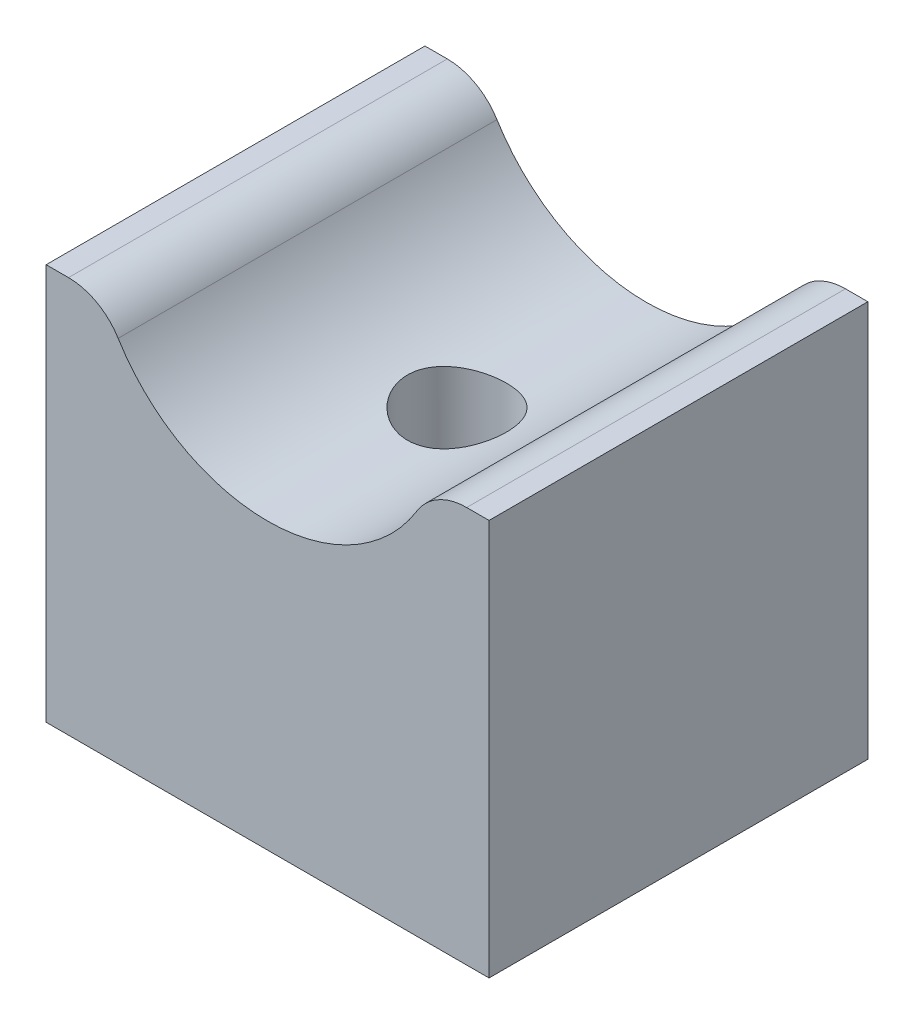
SolidWorks part; units mm, degrees
ref_plane "Ebene vorne" through (0, 0, 0) normal (0, 0, 1) x (1, 0, 0)
ref_plane "Ebene oben" through (0, 0, 0) normal (0, 1, 0) x (1, 0, 0)
ref_plane "Ebene rechts" through (0, 0, 0) normal (1, 0, 0) x (0, 0, -1)
sketch "Skizze1" plane through (0, 0, 0) normal (0, 0, 1) x (1, 0, 0)
  line L1 (-19, 17) -> (19, 17)
  line L2 (-19, 17) -> (-19, -17)
  line L3 (-19, -17) -> (19, -17)
  line L4 (19, 17) -> (19, -17)
  line L5 (-19, 17) -> (19, -17) construction
  line L6 (-19, -17) -> (19, 17) construction
  point P0 (0, 0)
  dimension "D1" = 38
  dimension "D2" = 34
extrude "Aufsatz-Linear austragen1" add sketch "Skizze1" along normal blind 32.5
sketch "Skizze2" plane through (0, 0, 0) normal (0, 0, 1) x (1, 0, 0)
  line L0 (0, 0) -> (0, 18.251) construction
  line L1 (-19, -17) -> (19, -17) construction
  circle A0 centre (0, 22.5) radius 15.05
  dimension "D1" = 39.5
  dimension "D2" = 30.1
extrude "Schnitt-Linear austragen1" cut sketch "Skizze2" along normal through all
sketch "Skizze3" plane through (0, -17, 0) normal (0, -1, 0) x (1, 0, 0)
  line L0 (-19, 0) -> (19, 0) construction
  point P0 (0, 16.25)
  dimension "D1" = 16.25
hole_wizard "Stirnsenkung für M8 Zylinderschraube mit Innensechskant1" positions "3D-Skizze1" profile "Skizze4" counterbore size "M8" standard "DIN"
sketch3d "3D-Skizze1"
  point P0 (0, -17, 16.25)
sketch "Skizze4" plane through (0, -17, 16.25) normal (1, 0, 0) x (0, 0, -1)
  line L0 (0, 0) -> (0, 34)
  line L1 (0, 34) -> (4.25, 34)
  line L3 (4.25, 34) -> (4.25, 2)
  line L4 (4.25, 2) -> (7.5065, 2)
  line L5 (7.5065, 2) -> (7.5065, 0)
  line L7 (7.5065, 0) -> (0, 0)
  line L11 (0, -6.35) -> (0, 107.95) construction
  dimension "Bohrerdurchmesser" = 8.5
  dimension "Bohrungstiefe" = 34
  dimension "Senkdurchmesser2" = 15.013
  dimension "Senktiefe2" = 2
fillet "Verrundung1" radius 5 2 edges at (-14.009, 17, 16.25) (14.009, 17, 16.25)
